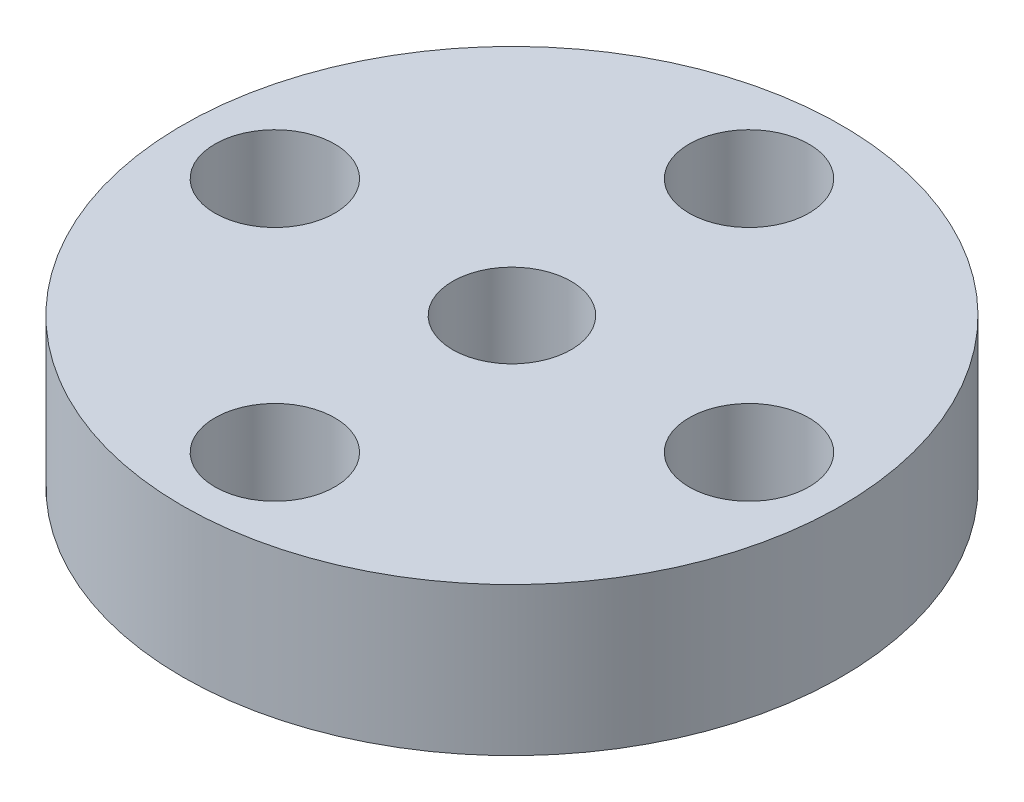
SolidWorks part; units mm, degrees
ref_plane "前视基准面" through (0, 0, 0) normal (0, 0, 1) x (1, 0, 0)
ref_plane "上视基准面" through (0, 0, 0) normal (0, 1, 0) x (1, 0, 0)
ref_plane "右视基准面" through (0, 0, 0) normal (1, 0, 0) x (0, 0, -1)
sketch "草图1" plane through (0, 0, 0) normal (0, 1, 0) x (1, 0, 0)
  circle A0 centre (-25.9967, 13.763) radius 11.1212
  circle A1 centre (-33.9967, 13.763) radius 2.022
  circle A2 centre (-17.9967, 13.763) radius 2.022
  circle A4 centre (-25.9967, 21.763) radius 2.022
  circle A5 centre (-25.9967, 5.763) radius 2.022
  circle A6 centre (-25.9967, 13.763) radius 2
  point P5 (0, 0)
  dimension "D1" = 8
  dimension "D2" = 2
extrude "凸台-拉伸1" add sketch "草图1" along normal blind 5
